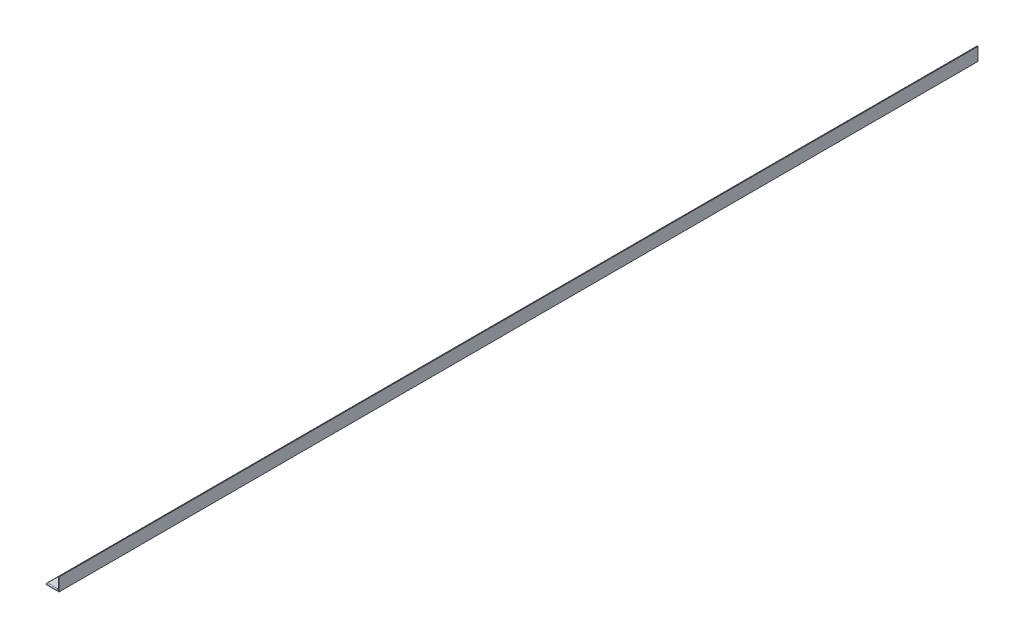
SolidWorks part; units mm, degrees
ref_plane "Plan de face" through (0, 0, 0) normal (0, 0, 1) x (1, 0, 0)
ref_plane "Plan de dessus" through (0, 0, 0) normal (0, 1, 0) x (1, 0, 0)
ref_plane "Plan de droite" through (0, 0, 0) normal (1, 0, 0) x (0, 0, -1)
sketch "Esquisse1" plane through (0, 0, 0) normal (0, 0, 1) x (1, 0, 0)
  line L0 (0, 0) -> (-30, 0)
  line L1 (-30, 0) -> (-30, 3)
  line L2 (-30, 3) -> (-3, 3)
  line L3 (-3, 3) -> (-3, 30)
  line L4 (-3, 30) -> (0, 30)
  line L5 (0, 30) -> (0, 0)
  dimension "D1" = 30
  dimension "D2" = 30
  dimension "D3" = 3
  dimension "D4" = 3
extrude "Boss.-Extru.1" add sketch "Esquisse1" along normal blind 2110
fillet "Congé1" radius 2 7 edges at (-30, 3, 1055) (-3, 30, 1055) (-16.5, 3, 2110) (-16.5, 3, 0) (-3, 16.5, 2110) (-3, 3, 1055) (-3, 16.5, 0)
